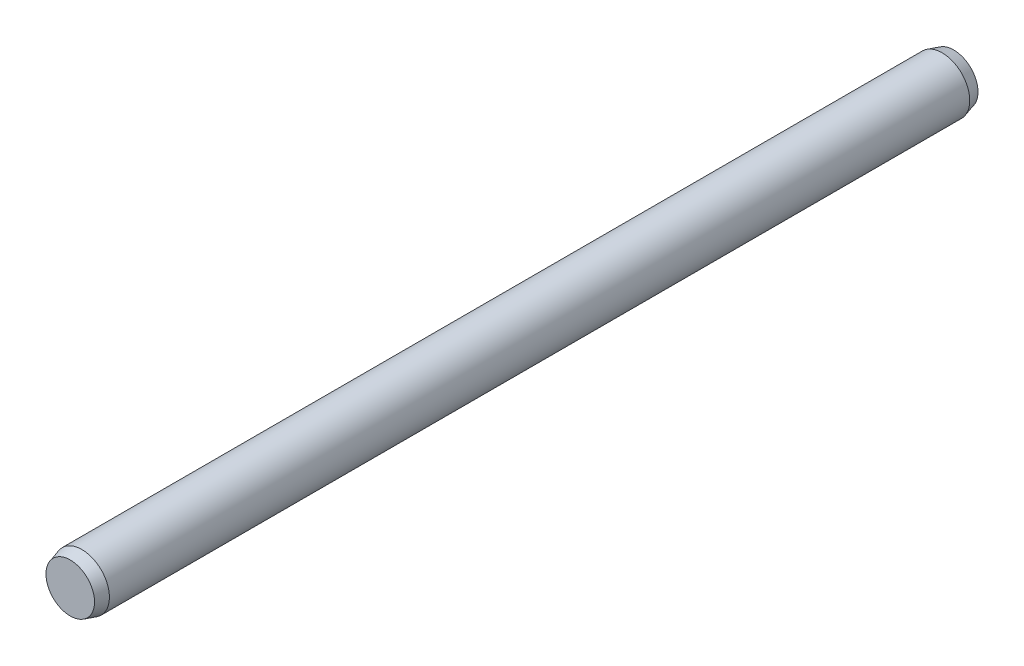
SolidWorks part; units mm, degrees
ref_plane "Front Plane" through (0, 0, 0) normal (0, 0, 1) x (1, 0, 0)
ref_plane "Top Plane" through (0, 0, 0) normal (0, 1, 0) x (1, 0, 0)
ref_plane "Right Plane" through (0, 0, 0) normal (1, 0, 0) x (0, 0, -1)
sketch "Sketch1" plane through (0, 0, 0) normal (0, 0, 1) x (1, 0, 0)
  circle A0 centre (0, 0) radius 1.5875
  point P3 (0, 1.5875)
  dimension "Diameter" = 3.175
sketch "Sketch2" plane through (0, 0, 0) normal (1, 0, 0) x (0, 0, -1)
  line L0 (-25.4, 0) -> (25.4, 0) construction
  line L1 (-25.4, 0) -> (-25.4, 1.5875)
  line L2 (-25.4, 1.5875) -> (25.4, 1.5875)
  line L3 (25.4, 1.5875) -> (25.4, 0)
  line L4 (-25.4, 1.397) -> (-24.7356, 1.5875)
  line L5 (25.4, 1.397) -> (24.7356, 1.5875)
  dimension "Length" = 50.8
  dimension "Chamfer Angle" = 16
  dimension "Point Diameter" = 2.794
sketch "Sketch3" plane through (0, 0, 0) normal (1, 0, 0) x (0, 0, -1)
  line L0 (-25.4, 0) -> (25.4, 0) construction
  line L1 (25.4, 1.5875) -> (25.4, 0) construction
  line L2 (-25.4, 1.5875) -> (25.4, 1.5875) construction
  line L3 (-25.4, 0) -> (-25.4, 1.5875) construction
  line L4 (-25.4, 0) -> (25.4, 0)
  line L5 (25.4, 1.397) -> (25.4, 0)
  line L6 (-24.7356, 1.5875) -> (24.7356, 1.5875)
  line L7 (-25.4, 0) -> (-25.4, 1.397)
  line L8 (25.4, 1.397) -> (24.7356, 1.5875) construction
  line L9 (-25.4, 1.397) -> (-24.7356, 1.5875) construction
  line L10 (25.4, 1.397) -> (24.7356, 1.5875)
  line L11 (-25.4, 1.397) -> (-24.7356, 1.5875)
revolve "Revolve1" add sketch "Sketch3" angle 360 about L0
